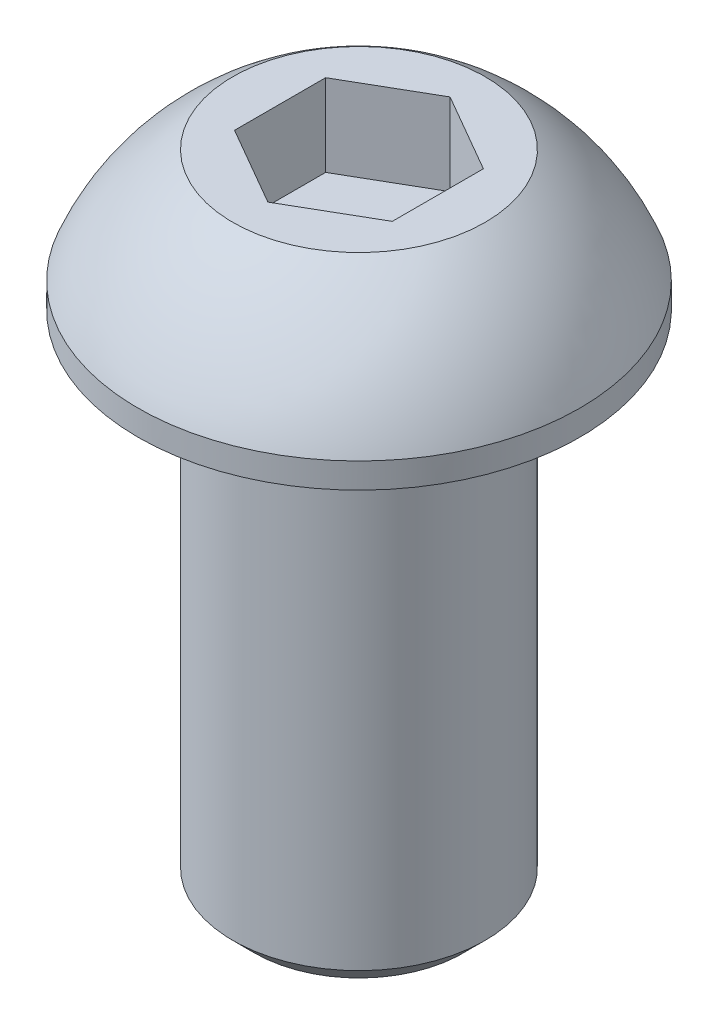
SolidWorks part; units mm, degrees
ref_plane "Face" through (0, 0, 0) normal (0, 0, 1) x (1, 0, 0)
ref_plane "Dessus" through (0, 0, 0) normal (0, 1, 0) x (1, 0, 0)
ref_plane "Droite" through (0, 0, 0) normal (1, 0, 0) x (0, 0, -1)
sketch "Esquisse1" plane through (0, 0, 0) normal (0, 0, 1) x (1, 0, 0)
  line L0 (0, 0) -> (7, 0)
  line L1 (7, 0) -> (7, 0.8)
  line L2 (4, 4.4) -> (0, 4.4)
  line L3 (0, 4.4) -> (0, 0)
  line L4 (0, 0) -> (0, 100) construction
  arc A0 (7, 0.8) -> (4, 4.4) centre (0, -1.9833) ccw
revolve "Base-Révolution" add sketch "Esquisse1" angle 360 about L4
sketch "Esquisse2" plane through (0, 0, 0) normal (0, 0, 1) x (1, 0, 0)
  line L0 (0, 0) -> (0, 100) construction
  line L1 (0, -16) -> (3.3095, -16)
  line L2 (3.3095, -16) -> (4, -15.3095)
  line L3 (4, -15.3095) -> (4, 0)
  line L4 (4, 0) -> (0, 0)
  line L5 (0, 0) -> (0, -16)
revolve "Boss.-Révol.1" add sketch "Esquisse2" angle 360 about L0
ref_plane "Plan4" through (0, 4.4, 0) normal (0, 1, 0) x (-1, 0, 0)
sketch "Esquisse3" plane through (0, 4.4, 0) normal (0, 1, 0) x (-1, 0, 0)
  line L0 (2.5, 1.4434) -> (0, 2.8868)
  line L1 (0, 2.8868) -> (-2.5, 1.4434)
  line L2 (-2.5, 1.4434) -> (-2.5, -1.4434)
  line L3 (-2.5, -1.4434) -> (0, -2.8868)
  line L4 (0, -2.8868) -> (2.5, -1.4434)
  line L5 (2.5, -1.4434) -> (2.5, 1.4434)
extrude "Enlèv. mat.-Extru.1" cut sketch "Esquisse3" against normal blind 2.6
